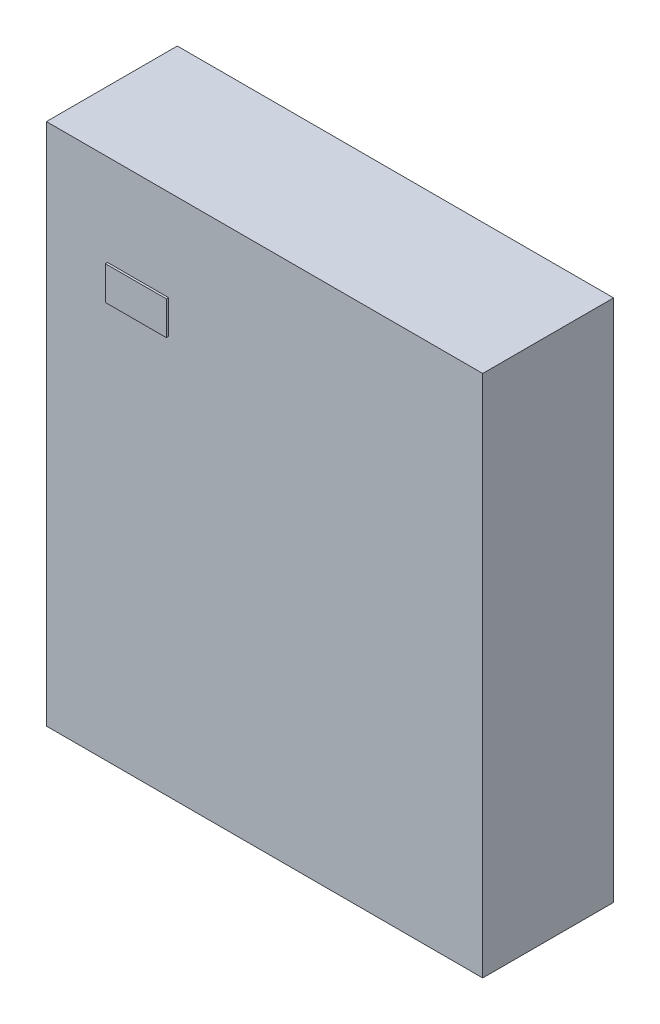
SolidWorks part; units mm, degrees
ref_plane "Plan de face" through (0, 0, 0) normal (0, 0, 1) x (1, 0, 0)
ref_plane "Plan de dessus" through (0, 0, 0) normal (0, 1, 0) x (1, 0, 0)
ref_plane "Plan de droite" through (0, 0, 0) normal (1, 0, 0) x (0, 0, -1)
sketch "Esquisse2" plane through (0, 0, 0) normal (0, 1, 0) x (1, 0, 0)
  line L1 (-500, 0) -> (500, 0)
  line L2 (-500, 0) -> (-500, -300)
  line L3 (-500, -300) -> (500, -300)
  line L4 (500, 0) -> (500, -300)
  dimension "D1" = 1000
  dimension "D2" = 300
extrude "Extrusion1" add sketch "Esquisse2" along normal blind 1200
hole_wizard "Diamètre du perçage M10.0 (10.000000)1" positions "Esquisse4" profile "Esquisse3" hole size "M10.0" standard "ISO"
sketch "Esquisse4" plane through (0, 0, 0) normal (0, 0, -1) x (-1, 0, 0)
  line L0 (-500, 1200) -> (-500, 0) construction
  line L1 (500, 1200) -> (500, 0) construction
  line L2 (-500, 1200) -> (500, 1200) construction
  line L3 (-500, 0) -> (500, 0) construction
  point P0 (-477.5, 1177.5)
  point P1 (477.5, 1177.5)
  point P2 (477.5, 22.5)
  point P3 (-477.5, 22.5)
  dimension "D1" = 22.5
  dimension "D2" = 22.5
  dimension "D3" = 22.5
  dimension "D4" = 22.5
sketch "Esquisse3" plane through (477.5, 1177.5, 0) normal (1, 0, 0) x (0, 1, 0)
  line L0 (0, 0) -> (0, 23.0043)
  line L1 (0, 23.0043) -> (5, 20)
  line L2 (5, 20) -> (5, 0)
  line L5 (5, 0) -> (0, 0)
  line L10 (0, 23.0043) -> (-5, 20) construction
  line L11 (0, -6.35) -> (0, 107.95) construction
  dimension "Diamètre du perçage" = 10
  dimension "Profondeur du perçage" = 20
  dimension "Angle de pointe" = 118
sketch "Esquisse5" plane through (0, 0, 0) normal (0, -1, 0) x (1, 0, 0)
  line L0 (500, 300) -> (500, 0) construction
  line L1 (450, 45) -> (50, 45)
  line L2 (475, 70) -> (475, 155)
  line L3 (450, 180) -> (50, 180)
  line L4 (25, 70) -> (25, 155)
  line L5 (-50, 45) -> (-450, 45)
  line L6 (-25, 70) -> (-25, 155)
  line L7 (-50, 180) -> (-450, 180)
  line L8 (-475, 70) -> (-475, 155)
  line L9 (500, 0) -> (-500, 0) construction
  line L10 (-500, 0) -> (-500, 300) construction
  arc A0 (450, 45) -> (475, 70) centre (450, 70) ccw
  arc A1 (475, 155) -> (450, 180) centre (450, 155) ccw
  arc A2 (50, 180) -> (25, 155) centre (50, 155) ccw
  arc A3 (50, 45) -> (25, 70) centre (50, 70) cw
  arc A4 (-50, 45) -> (-25, 70) centre (-50, 70) ccw
  arc A5 (-25, 155) -> (-50, 180) centre (-50, 155) ccw
  arc A6 (-450, 180) -> (-475, 155) centre (-450, 155) ccw
  arc A7 (-450, 45) -> (-475, 70) centre (-450, 70) cw
  point P20 (25, 180)
  point P23 (25, 45)
  dimension "D6" = 25
  dimension "D1" = 25
  dimension "D2" = 45
  dimension "D3" = 50
  dimension "D4" = 25
  dimension "D5" = 135
extrude "Enlèv. mat.-Extru.1" cut sketch "Esquisse5" against normal blind 3
sketch "Esquisse6" plane through (0, 0, 300) normal (0, 0, 1) x (1, 0, 0)
  line L1 (-360, 990.5) -> (-220, 990.5)
  line L2 (-360, 990.5) -> (-360, 913.5)
  line L3 (-360, 913.5) -> (-220, 913.5)
  line L4 (-220, 990.5) -> (-220, 913.5)
  line L5 (-500, 1200) -> (500, 1200) construction
  line L6 (500, 1200) -> (500, 0) construction
  point P4 (-290, 913.5)
  dimension "D1" = 140
  dimension "D2" = 77
  dimension "D3" = 790
  dimension "D4" = 209.5
extrude "Extrusion2" add sketch "Esquisse6" along normal blind 5
